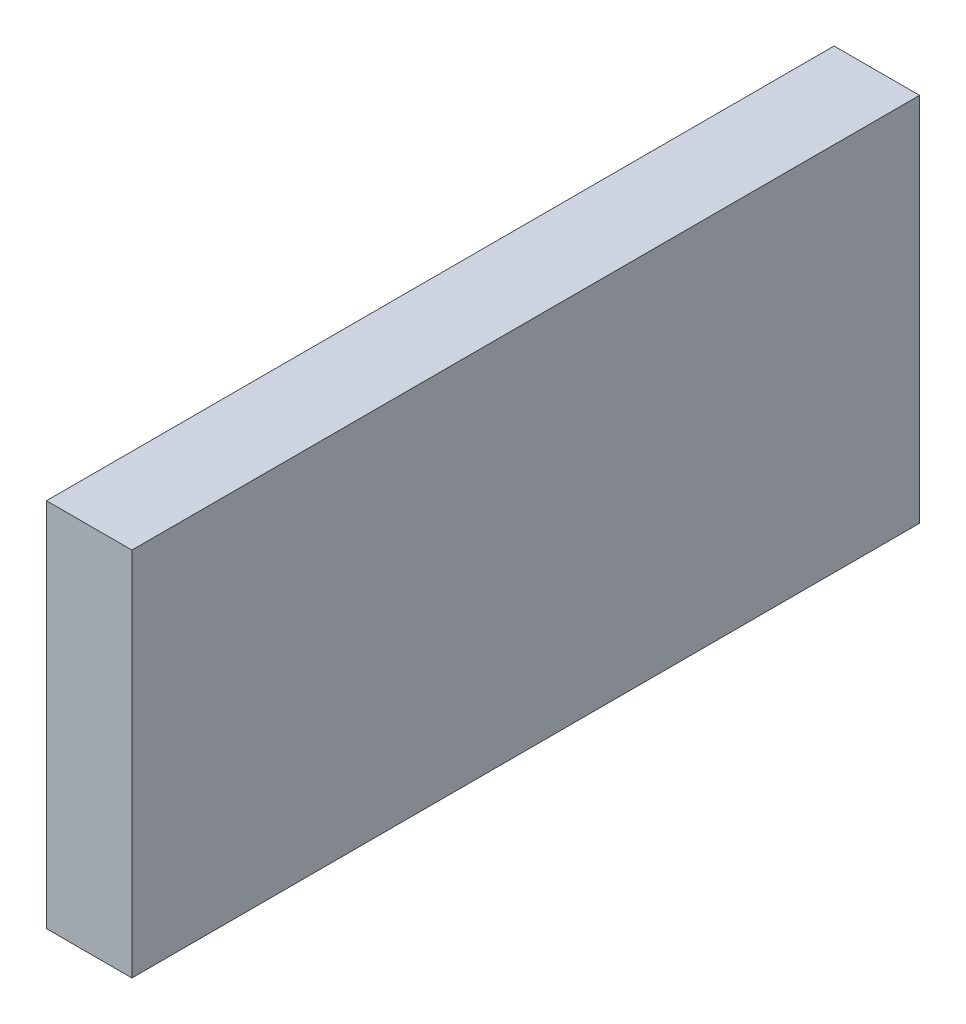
SolidWorks part; units mm, degrees
ref_plane "Front Plane" through (0, 0, 0) normal (0, 0, 1) x (1, 0, 0)
ref_plane "Top Plane" through (0, 0, 0) normal (0, 1, 0) x (1, 0, 0)
ref_plane "Right Plane" through (0, 0, 0) normal (1, 0, 0) x (0, 0, -1)
sketch "Sketch1" plane through (0, 0, 0) normal (0, 0, 1) x (1, 0, 0)
  line L1 (0, 0) -> (5.5118, 0)
  line L2 (0, 0) -> (0, -23.9014)
  line L3 (0, -23.9014) -> (5.5118, -23.9014)
  line L4 (5.5118, 0) -> (5.5118, -23.9014)
  dimension "D1" = 5.5118
  dimension "D2" = 23.9014
extrude "Boss-Extrude1" add sketch "Sketch1" against normal blind 50.8
